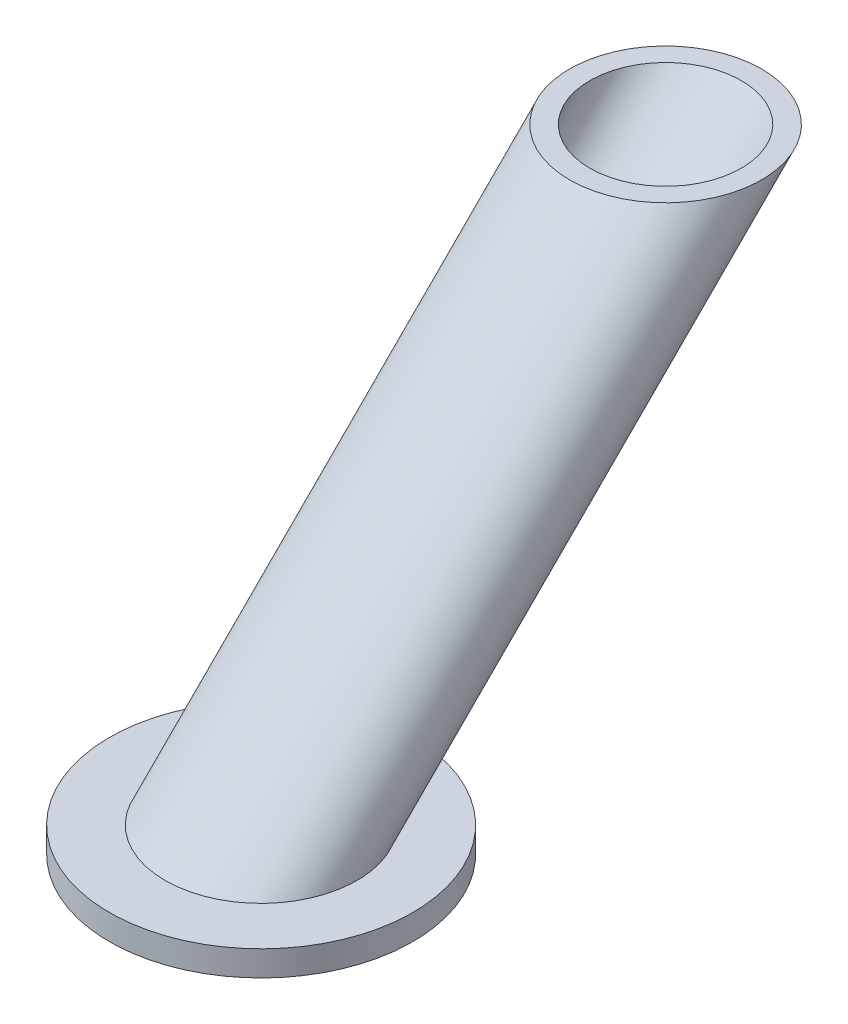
SolidWorks part; units mm, degrees
ref_plane "Front" through (0, 0, 0) normal (0, 0, 1) x (1, 0, 0)
ref_plane "Top" through (0, 0, 0) normal (0, 1, 0) x (1, 0, 0)
ref_plane "Right" through (0, 0, 0) normal (1, 0, 0) x (0, 0, -1)
sketch "Sketch1" plane through (0, 0, 0) normal (0, 1, 0) x (1, 0, 0)
  circle A0 centre (0, 0) radius 24.13
  circle A1 centre (0, 0) radius 19.05
  dimension "D1" = 48.26
  dimension "D2" = 38.1
sketch "Sketch2" plane through (0, 0, 0) normal (1, 0, 0) x (0, 0, -1)
  line L0 (0, 0) -> (-101.6, -101.6)
  line L1 (0, 0) -> (0, -22.4674) construction
  line L2 (24.13, 0) -> (-24.13, 0) construction
  dimension "D1" = 45
  dimension "D2" = 101.6
sweep "Sweep1" add profiles "Sketch1" path "Sketch2"
sketch "Sketch3" plane through (0, -101.6, 0) normal (0, -1, 0) x (1, 0, 0)
  circle A0 centre (0, 101.6) radius 38.1
  circle A1 centre (0, 101.6) radius 24.13 construction
  circle A2 centre (0, 101.6) radius 19.05
  circle A3 centre (0, 101.6) radius 19.05 construction
  dimension "D1" = 76.2
extrude "Extrude1" add sketch "Sketch3" along normal blind 6.35
